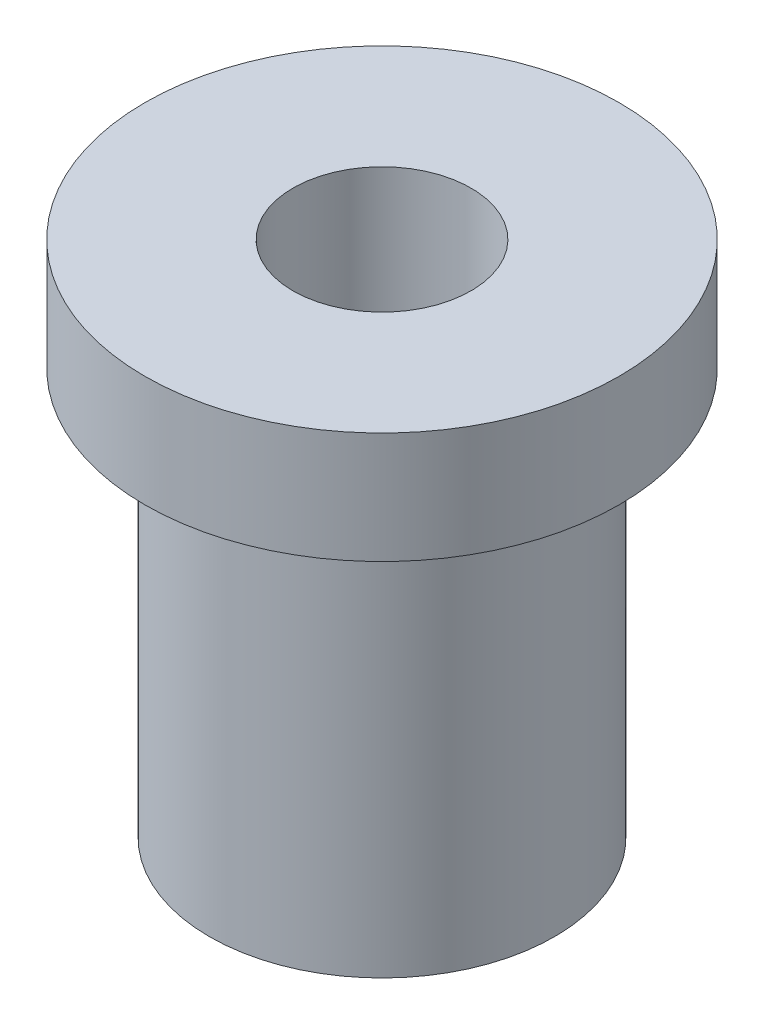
SolidWorks part; units mm, degrees
ref_plane "Plan de face" through (0, 0, 0) normal (0, 0, 1) x (1, 0, 0)
ref_plane "Plan de dessus" through (0, 0, 0) normal (0, 1, 0) x (1, 0, 0)
ref_plane "Plan de droite" through (0, 0, 0) normal (1, 0, 0) x (0, 0, -1)
sketch "Esquisse1" plane through (0, 0, 0) normal (0, 1, 0) x (1, 0, 0)
  circle A0 centre (0, 0) radius 1.6
  circle A1 centre (0, 0) radius 3.1
extrude "Boss.-Extru.1" add sketch "Esquisse1" along normal blind 7.3
sketch "Esquisse2" plane through (0, 7.3, 0) normal (0, 1, 0) x (1, 0, 0)
  circle A0 centre (0, 0) radius 1.6
  circle A1 centre (0, 0) radius 4.26
extrude "Boss.-Extru.2" add sketch "Esquisse2" along normal blind 2
